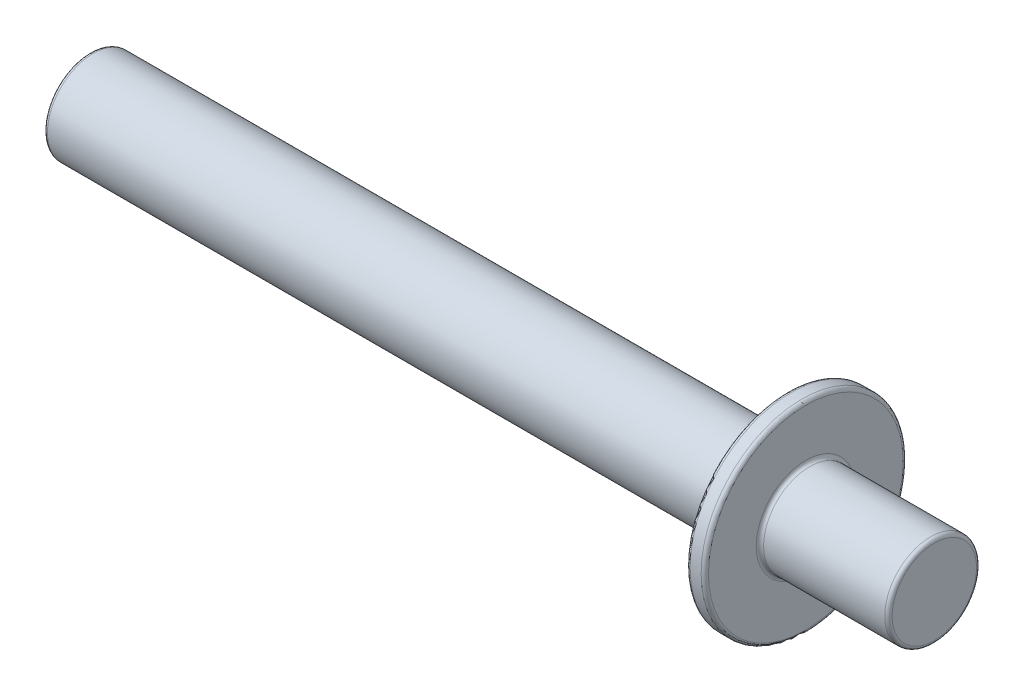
SolidWorks part; units mm, degrees
ref_plane "Face" through (0, 0, 0) normal (0, 0, 1) x (1, 0, 0)
ref_plane "Dessus" through (0, 0, 0) normal (0, 1, 0) x (1, 0, 0)
ref_plane "Droite" through (0, 0, 0) normal (1, 0, 0) x (0, 0, -1)
sketch "Esquisse1" plane through (0, 0, 0) normal (0, 0, 1) x (1, 0, 0)
  line L0 (-86.0867, 0) -> (77.888, 0) construction
  line L1 (-46, 0) -> (-46, 2.5)
  line L2 (-46, 2.5) -> (-8, 2.5)
  line L3 (-8, 2.5) -> (-8, 5.5)
  line L4 (-8, 5.5) -> (-7, 5.5)
  line L5 (-7, 5.5) -> (-7, 2.5)
  line L6 (-7, 2.5) -> (0, 2.5)
  line L7 (0, 2.5) -> (0, 0)
  line L8 (-46, 0) -> (0, 0)
  dimension "D1" = 5
  dimension "D2" = 11
  dimension "D3" = 1
  dimension "D4" = 7
  dimension "D5" = 46
revolve "Révolution1" add sketch "Esquisse1" angle 360 about L0
fillet "Congé1" radius 0.2
